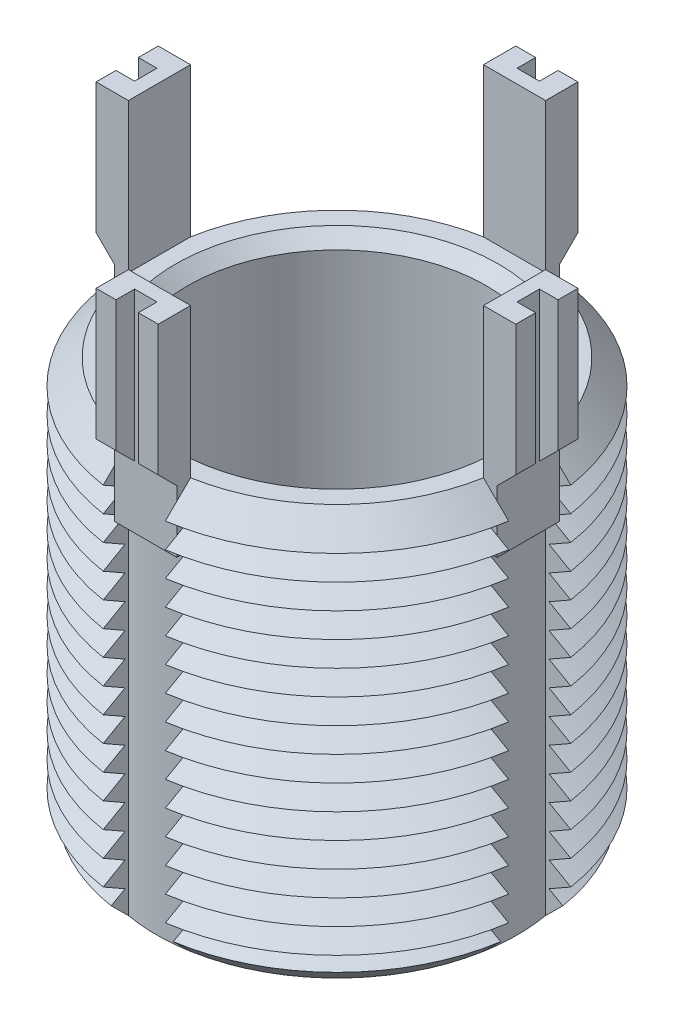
SolidWorks part; units mm, degrees
ref_plane "Front Plane" through (0, 0, 0) normal (0, 0, 1) x (1, 0, 0)
ref_plane "Top Plane" through (0, 0, 0) normal (0, 1, 0) x (1, 0, 0)
ref_plane "Right Plane" through (0, 0, 0) normal (1, 0, 0) x (0, 0, -1)
sketch "Sketch1" plane through (0, 0, 0) normal (0, 1, 0) x (1, 0, 0)
  circle A0 centre (0, 0) radius 16.5
  dimension "D1" = 33
extrude "Boss-Extrude1" add sketch "Sketch1" against normal blind 33
chamfer "Chamfer1" distance 2 angle 45 2 edges at (0, -33, 16.5) (0, 0, 16.5)
sketch "Sketch2" plane through (0, 0, 0) normal (1, 0, 0) x (0, 0, -1)
  line L0 (0, 0.8859) -> (0, -9.2617) construction
sketch "Sketch3" plane through (0, 0, 0) normal (1, 0, 0) x (0, 0, -1)
  line L0 (-16.5, -2) -> (-14.7679, -3)
  line L1 (-14.7679, -3) -> (-16.5, -4)
  line L2 (-16.5, -2) -> (-16.5, -31) construction
  line L3 (-16.5, -4) -> (-16.5, -2)
  dimension "D1" = 2
revolve "Cut-Revolve1" cut sketch "Sketch3" angle 360 about L0
pattern_linear "LPattern1" count 15 spacing 2 along (0, -1, 0) of "Cut-Revolve1"
sketch "Sketch4" plane through (0, 0, 0) normal (0, 1, 0) x (1, 0, 0)
  line L0 (-14.2829, 2.5) -> (-16.3095, 2.5)
  line L2 (-16.3095, -2.5) -> (-14.2829, -2.5)
  arc A0 (-14.2829, 2.5) -> (-14.2829, -2.5) centre (0, 0) ccw
  arc A1 (-16.3095, 2.5) -> (-16.3095, -2.5) centre (0, 0) ccw
  circle A2 centre (0, 0) radius 16.5 construction
  circle A3 centre (0, 0) radius 14.5 construction
  point P1 (-14.5, 0)
  point P3 (-16.5, 0)
  point P13 (0, 0)
  dimension "D1" = 5
extrude "Cut-Extrude1" cut sketch "Sketch4" against normal up to surface (33 mm away)
pattern_circular "CirPattern1" count 4 over 360 about axis through (0, 0, 0) along (0, 1, 0) of "Cut-Extrude1"
sketch "Sketch5" plane through (0, 0, 0) normal (1, 0, 0) x (0, 0, -1)
  line L0 (-14.2829, 12) -> (-14.2829, -5)
  line L1 (-14.2829, -5) -> (-15.3829, -5)
  line L2 (-15.3829, -5) -> (-15.3829, 0)
  line L3 (-15.3829, 0) -> (-16.8829, 1.5)
  line L4 (-16.8829, 1.5) -> (-16.8829, 12)
  line L5 (-16.8829, 12) -> (-14.2829, 12)
  line L6 (-16.3095, -6) -> (-2.5, -6) construction
  point P9 (-2.5, 0)
  point P10 (-15.3829, 0)
  dimension "D1" = 1
  dimension "D2" = 17
  dimension "D3" = 12
  dimension "D4" = 2.6
  dimension "D5" = 1.1
  dimension "D6" = 45
extrude "Boss-Extrude3" add sketch "Sketch5" along normal mid plane 5
pattern_circular "CirPattern2" count 4 over 360 about axis through (0, 0, 0) along (0, 1, 0) of "Boss-Extrude3"
sketch "Sketch6" plane through (0, 12, 0) normal (0, 1, 0) x (1, 0, 0)
  line L0 (-16.8829, -2.5) -> (-16.8829, 2.5) construction
  line L1 (-16.8829, -0.9) -> (-15.3829, -0.9)
  line L2 (-16.8829, -0.9) -> (-16.8829, 0.9)
  line L3 (-16.8829, 0.9) -> (-15.3829, 0.9)
  line L4 (-15.3829, -0.9) -> (-15.3829, 0.9)
  line L5 (-16.8829, -0.9) -> (-15.3829, 0.9) construction
  line L6 (-16.8829, 0.9) -> (-15.3829, -0.9) construction
  line L7 (16.8829, 2.5) -> (16.8829, -2.5) construction
  line L8 (-0.9, 15.3829) -> (0.9, 15.3829)
  line L9 (-0.9, 15.3829) -> (-0.9, 16.8829)
  line L10 (-0.9, 16.8829) -> (0.9, 16.8829)
  line L11 (0.9, 15.3829) -> (0.9, 16.8829)
  line L12 (-0.9, 15.3829) -> (0.9, 16.8829) construction
  line L13 (-0.9, 16.8829) -> (0.9, 15.3829) construction
  line L14 (15.3829, -0.9) -> (16.8829, -0.9)
  line L15 (15.3829, -0.9) -> (15.3829, 0.9)
  line L16 (15.3829, 0.9) -> (16.8829, 0.9)
  line L17 (16.8829, -0.9) -> (16.8829, 0.9)
  line L18 (15.3829, -0.9) -> (16.8829, 0.9) construction
  line L19 (15.3829, 0.9) -> (16.8829, -0.9) construction
  line L20 (-0.9, -16.8829) -> (0.9, -16.8829)
  line L21 (-0.9, -16.8829) -> (-0.9, -15.3829)
  line L22 (-0.9, -15.3829) -> (0.9, -15.3829)
  line L23 (0.9, -16.8829) -> (0.9, -15.3829)
  line L24 (-0.9, -16.8829) -> (0.9, -15.3829) construction
  line L25 (-0.9, -15.3829) -> (0.9, -16.8829) construction
  line L26 (-2.5, 16.8829) -> (2.5, 16.8829) construction
  line L27 (2.5, -16.8829) -> (-2.5, -16.8829) construction
  point P0 (-16.1329, 0)
  point P7 (-16.8829, 0)
  point P8 (-16.8829, 0)
  point P9 (0, 16.1329)
  point P14 (16.1329, 0)
  point P19 (0, -16.1329)
  point P24 (0, 16.8829)
  point P25 (16.8829, 0)
  point P26 (16.8829, 0)
  point P27 (0, 16.8829)
  point P30 (0, -16.8829)
  point P33 (0, -16.8829)
  dimension "D1" = 1.8
  dimension "D2" = 1.5
extrude "Cut-Extrude3" cut sketch "Sketch6" against normal through all both and the other way through all
sketch "Sketch7" plane through (0, 0, 0) normal (0, 1, 0) x (1, 0, 0)
  circle A0 centre (0, 0) radius 12
  dimension "D1" = 24
extrude "Cut-Extrude4" cut sketch "Sketch7" against normal up to surface (33 mm away)
chamfer "Chamfer2" distance 1 angle 45 2 edges at (0, 0, 12) (0, -33, 12)
